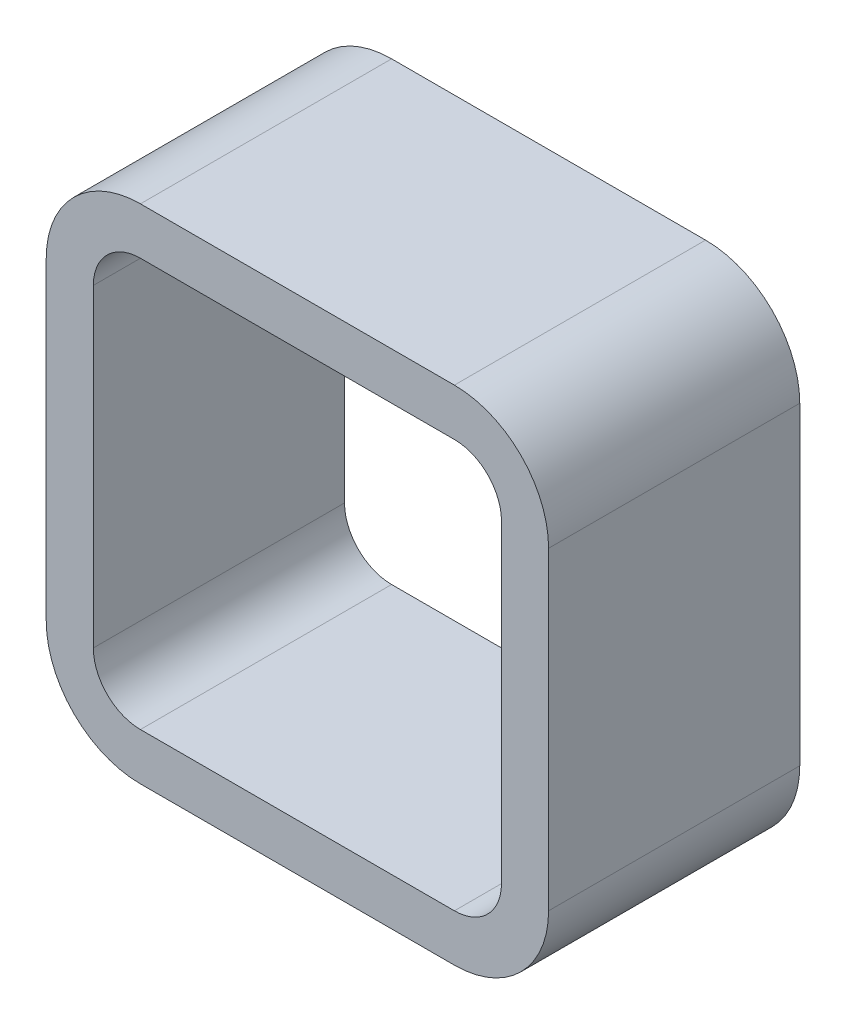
SolidWorks part; units mm, degrees
ref_plane "Plane1" through (0, 0, 0) normal (0, 0, 1) x (1, 0, 0)
ref_plane "Plane2" through (0, 0, 0) normal (0, 1, 0) x (1, 0, 0)
ref_plane "Plane3" through (0, 0, 0) normal (1, 0, 0) x (0, 0, -1)
sketch "Sketch1" plane through (0, 0, 0) normal (0, 0, 1) x (1, 0, 0)
  line L0 (9.525, 4.7625) -> (41.275, 4.7625)
  line L1 (4.7625, 9.525) -> (4.7625, 41.275)
  line L2 (41.275, 46.0375) -> (9.525, 46.0375)
  line L3 (46.0375, 41.275) -> (46.0375, 9.525)
  line L4 (9.525, 0) -> (41.275, 0)
  line L5 (0, 9.525) -> (0, 41.275)
  line L6 (41.275, 50.8) -> (9.525, 50.8)
  line L7 (50.8, 41.275) -> (50.8, 9.525)
  arc A0 (50.8, 41.275) -> (41.275, 50.8) centre (41.275, 41.275) ccw
  arc A1 (41.275, 0) -> (50.8, 9.525) centre (41.275, 9.525) ccw
  arc A2 (0, 9.525) -> (9.525, 0) centre (9.525, 9.525) ccw
  arc A3 (9.525, 50.8) -> (0, 41.275) centre (9.525, 41.275) ccw
  arc A4 (9.525, 46.0375) -> (4.7625, 41.275) centre (9.525, 41.275) ccw
  arc A5 (46.0375, 41.275) -> (41.275, 46.0375) centre (41.275, 41.275) ccw
  arc A6 (41.275, 4.7625) -> (46.0375, 9.525) centre (41.275, 9.525) ccw
  arc A7 (4.7625, 9.525) -> (9.525, 4.7625) centre (9.525, 9.525) ccw
extrude "BaseTubeS" add sketch "Sketch1" along normal mid plane 25.4
equation "\"D1@Sketch1\" = \"Thickness@Sketch1\" * 2"
